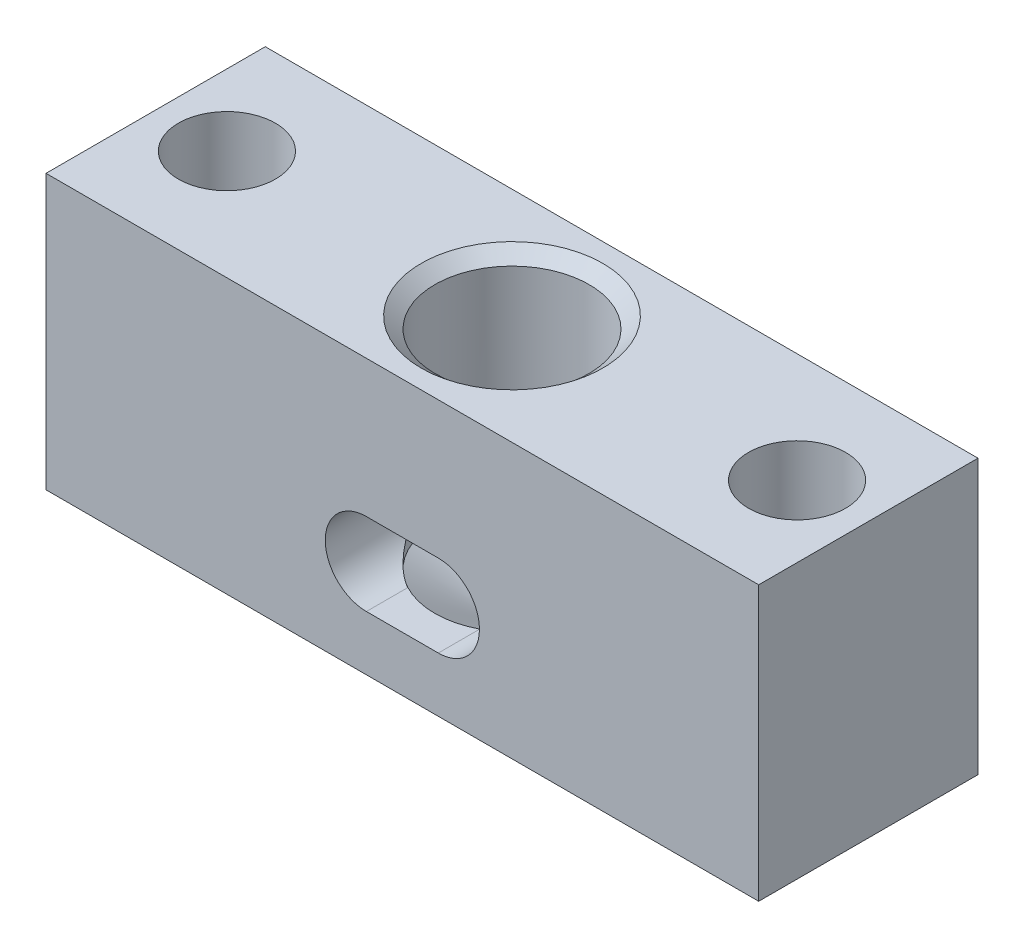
SolidWorks part; units mm, degrees
ref_plane "Front Plane" through (0, 0, 0) normal (0, 0, 1) x (1, 0, 0)
ref_plane "Top Plane" through (0, 0, 0) normal (0, 1, 0) x (1, 0, 0)
ref_plane "Right Plane" through (0, 0, 0) normal (1, 0, 0) x (0, 0, -1)
sketch "Sketch1" plane through (0, 0, 0) normal (0, 0, 1) x (1, 0, 0)
  line L1 (-29.3592, 20.1742) -> (3.6608, 20.1742)
  line L2 (-29.3592, 20.1742) -> (-29.3592, 7.4742)
  line L3 (-29.3592, 7.4742) -> (3.6608, 7.4742)
  line L4 (3.6608, 20.1742) -> (3.6608, 7.4742)
extrude "Boss-Extrude1" add sketch "Sketch1" along normal blind 10.16
hole_wizard "#16 (0.177) Diameter Hole1" positions "Sketch4" profile "Sketch5" hole size "#16" standard "ANSI Inch"
sketch "Sketch4" plane through (0, 20.1742, 0) normal (0, 1, 0) x (1, 0, 0)
  line L0 (3.6608, 0) -> (-29.3592, 0) construction
  line L1 (3.6608, -10.16) -> (3.6608, 0) construction
  line L2 (-29.3592, -10.16) -> (-29.3592, 0) construction
  point P0 (-26.0572, -5.08)
  point P2 (0.3588, -5.08)
  dimension "D1" = 5.08
  dimension "D2" = 5.08
  dimension "D3" = 3.302
  dimension "D4" = 3.302
sketch "Sketch5" plane through (-26.0572, 20.1742, 5.08) normal (1, 0, 0) x (0, 0, 1)
  line L0 (0, 0) -> (0, 12.7)
  line L1 (0, 12.7) -> (2.2479, 12.7)
  line L2 (2.2479, 12.7) -> (2.2479, 0)
  line L5 (2.2479, 0) -> (0, 0)
  line L11 (0, -6.35) -> (0, 107.95) construction
  dimension "Thru Hole Dia." = 4.4958
  dimension "Thru Hole Depth" = 12.7
hole_wizard "9/32 (0.28125) Diameter Hole2" positions "Sketch6" profile "Sketch7" hole size "9/32" standard "ANSI Inch"
sketch "Sketch6" plane through (0, 20.1742, 0) normal (0, 1, 0) x (1, 0, 0)
  line L0 (3.6608, 0) -> (-29.3592, 0) construction
  line L1 (3.6608, -10.16) -> (3.6608, 0) construction
  point P0 (-12.8492, -5.08)
  dimension "D1" = 5.08
  dimension "D2" = 16.51
sketch "Sketch7" plane through (-12.8492, 20.1742, 5.08) normal (1, 0, 0) x (0, 0, 1)
  line L0 (0, 0) -> (0, 12.3062)
  line L1 (0, 12.3062) -> (3.5719, 10.16)
  line L2 (3.5719, 10.16) -> (3.5719, 0.5328)
  line L3 (3.5719, 0.5328) -> (4.2069, 0)
  line L5 (4.2069, 0) -> (0, 0)
  line L6 (-3.5719, 0.5328) -> (-4.2069, 0) construction
  line L10 (0, 12.3062) -> (-3.5719, 10.16) construction
  line L11 (0, -6.35) -> (0, 107.95) construction
  dimension "Hole Dia." = 7.1437
  dimension "Hole Depth" = 10.16
  dimension "Near C'Sink Dia." = 8.4137
  dimension "Near C'Sink Angle" = 100
  dimension "Drill Angle" = 118
sketch "Sketch8" plane through (0, 0, 10.16) normal (0, 0, 1) x (1, 0, 0)
  line L0 (-14.5154, 11.9192) -> (-11.183, 11.9192) construction
  line L1 (3.6608, 7.4742) -> (3.6608, 20.1742) construction
  line L2 (-14.5154, 13.8242) -> (-11.183, 13.8242)
  line L3 (-14.5154, 10.0142) -> (-11.183, 10.0142)
  line L4 (3.6608, 20.1742) -> (-29.3592, 20.1742) construction
  arc A0 (-14.5154, 13.8242) -> (-14.5154, 10.0142) centre (-14.5154, 11.9192) ccw
  arc A1 (-11.183, 10.0142) -> (-11.183, 13.8242) centre (-11.183, 11.9192) ccw
  point P2 (-9.278, 11.9192)
  point P3 (-16.4204, 11.9192)
  point P4 (-12.8492, 11.9192)
  dimension "D1" = 3.81
  dimension "D3" = 16.51
  dimension "D2" = 7.1425
  dimension "D4" = 10.16
extrude "Cut-Extrude1" cut sketch "Sketch8" against normal through all
